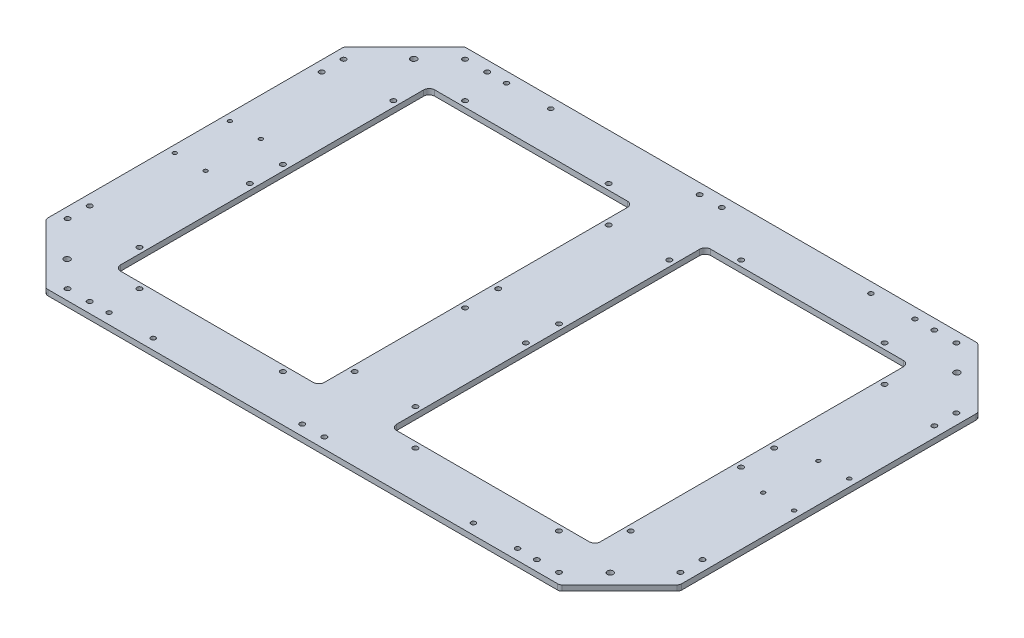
SolidWorks part; units mm, degrees
ref_plane "Ebene vorne" through (0, 0, 0) normal (0, 0, 1) x (1, 0, 0)
ref_plane "Ebene oben" through (0, 0, 0) normal (0, 1, 0) x (1, 0, 0)
ref_plane "Ebene rechts" through (0, 0, 0) normal (1, 0, 0) x (0, 0, -1)
sketch "Skizze1" plane through (0, 0, 0) normal (0, 1, 0) x (1, 0, 0)
  line L0 (-466, 381) -> (-576, 271)
  line L1 (-466, -381) -> (466, -381)
  line L2 (-466, -381) -> (-466, 381) construction
  line L3 (-466, 381) -> (466, 381)
  line L4 (466, -381) -> (466, 381) construction
  line L5 (-466, -381) -> (466, 381) construction
  line L6 (-466, 381) -> (466, -381) construction
  line L7 (-576, 271) -> (-576, -271)
  line L8 (-576, -271) -> (-466, -381)
  line L9 (466, -381) -> (576, -271)
  line L10 (576, -271) -> (576, 271)
  line L11 (576, 271) -> (466, 381)
  line L12 (-662.0681, 0) -> (0, 0) construction
  line L13 (0, 0) -> (684.1196, 0) construction
  line L14 (-53.5395, 0) -> (53.5395, 0) construction
  point P0 (0, 0)
  dimension "D1" = 932
  dimension "D2" = 762
  dimension "D3" = 45
  dimension "D4" = 110
extrude "Aufsatz-Linear austragen1" add sketch "Skizze1" along normal blind 10
hole_wizard "Durchgangsloch für M81" positions "Skizze2" profile "Skizze3" hole size "M8" standard "DIN"
sketch "Skizze2" plane through (0, 10, 0) normal (0, 1, 0) x (1, 0, 0)
  line L1 (445, -360) -> (-445, -360)
  line L2 (445, -360) -> (445, 360)
  line L3 (445, 360) -> (-445, 360)
  line L4 (-445, -360) -> (-445, 360)
  line L5 (445, -360) -> (-445, 360) construction
  line L6 (445, 360) -> (-445, -360) construction
  line L8 (0, 0) -> (0, 387.6038) construction
  line L10 (-555, 250) -> (-555, 210) construction
  line L11 (-555, 210) -> (-555, -210) construction
  line L12 (-555, -210) -> (-555, -250) construction
  line L14 (-555, 0) -> (0, 0) construction
  line L17 (555, -210) -> (555, -250) construction
  line L18 (555, 210) -> (555, -210) construction
  line L19 (555, 250) -> (555, 210) construction
  point P2 (-445, 360)
  point P5 (445, -360)
  point P6 (445, 360)
  point P7 (-445, -360)
  point P63 (-405, 360)
  point P65 (-405, -360)
  point P67 (405, -360)
  point P69 (405, 360)
  point P79 (-555, 250)
  point P81 (-555, 210)
  point P83 (-555, -210)
  point P85 (-555, -250)
  point P108 (555, 250)
  point P111 (555, 210)
  point P114 (555, -210)
  point P117 (555, -250)
  point P122 (-20, 360)
  point P124 (20, 360)
  point P126 (-20, -360)
  point P128 (20, -360)
  dimension "D1" = 720
  dimension "D2" = 890
  dimension "D3" = 40
  dimension "D4" = 40
  dimension "D5" = 1110
  dimension "D6" = 500
  dimension "D7" = 40
sketch "Skizze3" plane through (-445, 10, -360) normal (1, 0, 0) x (0, 0, 1)
  line L0 (0, 0) -> (0, 10)
  line L1 (0, 10) -> (4.5, 10)
  line L2 (4.5, 10) -> (4.5, 0)
  line L5 (4.5, 0) -> (0, 0)
  line L11 (0, -6.35) -> (0, 107.95) construction
  dimension "Bohrerdurchmesser" = 9
  dimension "Bohrungstiefe" = 10
fillet "Verrundung1" radius 10
sketch "Skizze4" plane through (0, 10, 0) normal (0, 1, 0) x (1, 0, 0)
  line L16 (-467.5147, 376.6569) -> (-571.6569, 272.5147)
  line L17 (-574, 266.8579) -> (-574, -266.8579)
  line L18 (-571.6569, -272.5147) -> (-467.5147, -376.6569)
  line L19 (-461.8579, -379) -> (461.8579, -379)
  line L20 (467.5147, -376.6569) -> (571.6569, -272.5147)
  line L21 (574, -266.8579) -> (574, 266.8579)
  line L22 (571.6569, 272.5147) -> (467.5147, 376.6569)
  line L23 (461.8579, 379) -> (-461.8579, 379)
  line L24 (-467.5147, 376.6569) -> (-571.6569, 272.5147)
  line L25 (-574, 266.8579) -> (-574, -266.8579)
  line L26 (-571.6569, -272.5147) -> (-467.5147, -376.6569)
  line L27 (-461.8579, -379) -> (461.8579, -379)
  line L28 (467.5147, -376.6569) -> (571.6569, -272.5147)
  line L29 (574, -266.8579) -> (574, 266.8579)
  line L30 (571.6569, 272.5147) -> (467.5147, 376.6569)
  line L31 (461.8579, 379) -> (-461.8579, 379)
  line L32 (-468.9289, 378.0711) -> (-573.0711, 273.9289)
  line L33 (-576, 266.8579) -> (-576, -266.8579)
  line L34 (-573.0711, -273.9289) -> (-468.9289, -378.0711)
  line L35 (-461.8579, -381) -> (461.8579, -381)
  line L36 (468.9289, -378.0711) -> (573.0711, -273.9289)
  line L37 (576, -266.8579) -> (576, 266.8579)
  line L38 (573.0711, 273.9289) -> (468.9289, 378.0711)
  line L39 (461.8579, 381) -> (-461.8579, 381)
  line L40 (-468.9289, 378.0711) -> (-573.0711, 273.9289)
  line L41 (-576, 266.8579) -> (-576, -266.8579)
  line L42 (-573.0711, -273.9289) -> (-468.9289, -378.0711)
  line L43 (-461.8579, -381) -> (461.8579, -381)
  line L44 (468.9289, -378.0711) -> (573.0711, -273.9289)
  line L45 (576, -266.8579) -> (576, 266.8579)
  line L46 (573.0711, 273.9289) -> (468.9289, 378.0711)
  line L47 (461.8579, 381) -> (-461.8579, 381)
  arc A16 (-571.6569, 272.5147) -> (-574, 266.8579) centre (-566, 266.8579) ccw
  arc A17 (-574, -266.8579) -> (-571.6569, -272.5147) centre (-566, -266.8579) ccw
  arc A18 (-467.5147, -376.6569) -> (-461.8579, -379) centre (-461.8579, -371) ccw
  arc A19 (461.8579, -379) -> (467.5147, -376.6569) centre (461.8579, -371) ccw
  arc A20 (571.6569, -272.5147) -> (574, -266.8579) centre (566, -266.8579) ccw
  arc A21 (574, 266.8579) -> (571.6569, 272.5147) centre (566, 266.8579) ccw
  arc A22 (467.5147, 376.6569) -> (461.8579, 379) centre (461.8579, 371) ccw
  arc A23 (-461.8579, 379) -> (-467.5147, 376.6569) centre (-461.8579, 371) ccw
  arc A24 (-571.6569, 272.5147) -> (-574, 266.8579) centre (-566, 266.8579) ccw
  arc A25 (-574, -266.8579) -> (-571.6569, -272.5147) centre (-566, -266.8579) ccw
  arc A26 (-467.5147, -376.6569) -> (-461.8579, -379) centre (-461.8579, -371) ccw
  arc A27 (461.8579, -379) -> (467.5147, -376.6569) centre (461.8579, -371) ccw
  arc A28 (571.6569, -272.5147) -> (574, -266.8579) centre (566, -266.8579) ccw
  arc A29 (574, 266.8579) -> (571.6569, 272.5147) centre (566, 266.8579) ccw
  arc A30 (467.5147, 376.6569) -> (461.8579, 379) centre (461.8579, 371) ccw
  arc A31 (-461.8579, 379) -> (-467.5147, 376.6569) centre (-461.8579, 371) ccw
  arc A32 (-573.0711, 273.9289) -> (-576, 266.8579) centre (-566, 266.8579) ccw
  arc A33 (-576, -266.8579) -> (-573.0711, -273.9289) centre (-566, -266.8579) ccw
  arc A34 (-468.9289, -378.0711) -> (-461.8579, -381) centre (-461.8579, -371) ccw
  arc A35 (461.8579, -381) -> (468.9289, -378.0711) centre (461.8579, -371) ccw
  arc A36 (573.0711, -273.9289) -> (576, -266.8579) centre (566, -266.8579) ccw
  arc A37 (576, 266.8579) -> (573.0711, 273.9289) centre (566, 266.8579) ccw
  arc A38 (468.9289, 378.0711) -> (461.8579, 381) centre (461.8579, 371) ccw
  arc A39 (-461.8579, 381) -> (-468.9289, 378.0711) centre (-461.8579, 371) ccw
  arc A40 (-573.0711, 273.9289) -> (-576, 266.8579) centre (-566, 266.8579) ccw
  arc A41 (-576, -266.8579) -> (-573.0711, -273.9289) centre (-566, -266.8579) ccw
  arc A42 (-468.9289, -378.0711) -> (-461.8579, -381) centre (-461.8579, -371) ccw
  arc A43 (461.8579, -381) -> (468.9289, -378.0711) centre (461.8579, -371) ccw
  arc A44 (573.0711, -273.9289) -> (576, -266.8579) centre (566, -266.8579) ccw
  arc A45 (576, 266.8579) -> (573.0711, 273.9289) centre (566, 266.8579) ccw
  arc A46 (468.9289, 378.0711) -> (461.8579, 381) centre (461.8579, 371) ccw
  arc A47 (-461.8579, 381) -> (-468.9289, 378.0711) centre (-461.8579, 371) ccw
  dimension "D1" = 2
  dimension "D2" = 0
extrude "Schnitt-Linear austragen1" cut sketch "Skizze4" against normal through all
hole_wizard "Durchgangsloch für M101" positions "Skizze5" profile "Skizze6" hole size "M10" standard "DIN"
sketch "Skizze5" plane through (0, 10, 0) normal (0, 1, 0) x (1, 0, 0)
  line L1 (492, -314) -> (-492, -314)
  line L2 (492, -314) -> (492, 314)
  line L3 (492, 314) -> (-492, 314)
  line L4 (-492, -314) -> (-492, 314)
  line L5 (492, -314) -> (-492, 314) construction
  line L6 (492, 314) -> (-492, -314) construction
  line L7 (574, -266.8579) -> (574, 266.8579) construction
  line L8 (461.8579, 379) -> (-461.8579, 379) construction
  point P2 (-492, 314)
  point P5 (492, -314)
  point P6 (492, 314)
  point P7 (-492, -314)
  dimension "D1" = 65
  dimension "D2" = 82
sketch "Skizze6" plane through (-492, 10, -314) normal (1, 0, 0) x (0, 0, 1)
  line L0 (0, 0) -> (0, 10)
  line L1 (0, 10) -> (5.5, 10)
  line L2 (5.5, 10) -> (5.5, 0)
  line L5 (5.5, 0) -> (0, 0)
  line L11 (0, -6.35) -> (0, 107.95) construction
  dimension "Bohrerdurchmesser" = 11
  dimension "Bohrungstiefe" = 10
hole_wizard "Ø7.0 (7) Durchmesser Bohrung1" positions "Skizze7" profile "Skizze8" hole size "Ø7.0" standard "DIN"
sketch "Skizze7" plane through (0, 0, 0) normal (0, -1, 0) x (-1, 0, 0)
  line L0 (0, 0) -> (-616.7113, 0) construction
  line L1 (-53.5395, 0) -> (53.5395, 0) construction
  line L3 (0, 53.599) -> (0, -53.599) construction
  line L4 (0, 0) -> (0, 419.4426) construction
  point P0 (-561, 50)
  point P3 (-505, 50)
  point P6 (-561, -50)
  point P9 (-505, -50)
  point P34 (505, -50)
  point P35 (561, -50)
  point P36 (505, 50)
  point P37 (561, 50)
  dimension "D1" = 100
  dimension "D2" = 56
  dimension "D3" = 505
sketch "Skizze8" plane through (561, 0, -50) normal (1, 0, 0) x (0, 0, -1)
  line L0 (0, 0) -> (0, 14.103)
  line L1 (0, 14.103) -> (3.5, 12)
  line L2 (3.5, 12) -> (3.5, 0)
  line L5 (3.5, 0) -> (0, 0)
  line L10 (0, 14.103) -> (-3.5, 12) construction
  line L11 (0, -6.35) -> (0, 107.95) construction
  dimension "Bohrerdurchmesser" = 7
  dimension "Bohrungstiefe" = 12
  dimension "Spitzenwinkel" = 118
sketch "Skizze10" plane through (0, 0, 0) normal (0, -1, 0) x (1, 0, 0)
  line L0 (0, 0) -> (0, 411.895) construction
  line L1 (-424.5, -284.5) -> (-75.5, -284.5)
  line L2 (-434.5, -274.5) -> (-434.5, 274.5)
  line L3 (-424.5, 284.5) -> (-75.5, 284.5)
  line L4 (-65.5, -274.5) -> (-65.5, 274.5)
  line L5 (-434.5, -284.5) -> (-65.5, 284.5) construction
  line L6 (-434.5, 284.5) -> (-65.5, -284.5) construction
  line L7 (434.5, 284.5) -> (65.5, -284.5) construction
  line L8 (434.5, -284.5) -> (65.5, 284.5) construction
  line L9 (65.5, -274.5) -> (65.5, 274.5)
  line L10 (424.5, 284.5) -> (75.5, 284.5)
  line L11 (434.5, -274.5) -> (434.5, 274.5)
  line L12 (424.5, -284.5) -> (75.5, -284.5)
  arc A0 (-434.5, -274.5) -> (-424.5, -284.5) centre (-424.5, -274.5) ccw
  arc A1 (-75.5, -284.5) -> (-65.5, -274.5) centre (-75.5, -274.5) ccw
  arc A2 (-65.5, 274.5) -> (-75.5, 284.5) centre (-75.5, 274.5) ccw
  arc A3 (-424.5, 284.5) -> (-434.5, 274.5) centre (-424.5, 274.5) ccw
  arc A4 (424.5, 284.5) -> (434.5, 274.5) centre (424.5, 274.5) cw
  arc A5 (65.5, 274.5) -> (75.5, 284.5) centre (75.5, 274.5) cw
  arc A6 (75.5, -284.5) -> (65.5, -274.5) centre (75.5, -274.5) cw
  arc A7 (434.5, -274.5) -> (424.5, -284.5) centre (424.5, -274.5) cw
  point P0 (-250, 0)
  point P36 (250, 0)
  dimension "D4" = 10
  dimension "D1" = 369
  dimension "D2" = 569
  dimension "D3" = 250
extrude "Schnitt-Linear austragen3" cut sketch "Skizze10" against normal through all
sketch "Skizze11" [suppressed] plane through (0, 0, 0) normal (0, -1, 0) x (1, 0, 0)
  line L1 (-437.5, -147.5) -> (-262.5, -147.5)
  line L2 (-447.5, -137.5) -> (-447.5, 137.5)
  line L3 (-437.5, 147.5) -> (-262.5, 147.5)
  line L4 (-252.5, -137.5) -> (-252.5, 137.5)
  line L5 (-447.5, -147.5) -> (-252.5, 147.5) construction
  line L6 (-447.5, 147.5) -> (-252.5, -147.5) construction
  line L7 (447.5, 147.5) -> (252.5, -147.5) construction
  line L8 (447.5, -147.5) -> (252.5, 147.5) construction
  line L9 (252.5, -137.5) -> (252.5, 137.5)
  line L10 (437.5, 147.5) -> (262.5, 147.5)
  line L11 (447.5, -137.5) -> (447.5, 137.5)
  line L12 (437.5, -147.5) -> (262.5, -147.5)
  line L13 (0, 0) -> (0, 303.9427) construction
  line L14 (0, -53.599) -> (0, 53.599) construction
  arc A0 (-447.5, -137.5) -> (-437.5, -147.5) centre (-437.5, -137.5) ccw
  arc A1 (-262.5, -147.5) -> (-252.5, -137.5) centre (-262.5, -137.5) ccw
  arc A2 (-252.5, 137.5) -> (-262.5, 147.5) centre (-262.5, 137.5) ccw
  arc A3 (-437.5, 147.5) -> (-447.5, 137.5) centre (-437.5, 137.5) ccw
  arc A4 (437.5, 147.5) -> (447.5, 137.5) centre (437.5, 137.5) cw
  arc A5 (252.5, 137.5) -> (262.5, 147.5) centre (262.5, 137.5) cw
  arc A6 (262.5, -147.5) -> (252.5, -137.5) centre (262.5, -137.5) cw
  arc A7 (447.5, -137.5) -> (437.5, -147.5) centre (437.5, -137.5) cw
  point P0 (-350, 0)
  point P38 (350, 0)
  dimension "D4" = 10
  dimension "D1" = 295
  dimension "D2" = 195
  dimension "D3" = 350
extrude "Schnitt-Linear austragen4" [suppressed] cut sketch "Skizze11" against normal through all
sketch "Skizze12" plane through (0, 0, 0) normal (0, -1, 0) x (1, 0, 0)
  line L0 (120, 295) -> (380, 295) construction
  line L1 (55, 230) -> (55, -230) construction
  line L2 (120, -295) -> (380, -295) construction
  line L3 (445, 230) -> (445, -230) construction
  line L4 (-75.5, 284.5) -> (-424.5, 284.5) construction
  line L7 (53.5395, 0) -> (-53.5395, 0) construction
  line L8 (445, 30) -> (55, 30) construction
  line L9 (445, -30) -> (55, -30) construction
  line L10 (120, 295) -> (120, -295) construction
  line L11 (380, 295) -> (380, -295) construction
  line L12 (-424.5, -284.5) -> (-75.5, -284.5) construction
  line L13 (434.5, -274.5) -> (434.5, 274.5) construction
  line L14 (65.5, 274.5) -> (65.5, -274.5) construction
  point P16 (445, -30)
  point P17 (445, 30)
  point P18 (55, 30)
  point P19 (55, -30)
  dimension "D1" = 10.5
  dimension "D2" = 54.5
  dimension "D3" = 10.5
  dimension "D4" = 230
  dimension "D5" = 230
  dimension "D6" = 230
  dimension "D7" = 230
  dimension "D8" = 30
  dimension "D9" = 30
  dimension "D10" = 10.5
  dimension "D11" = 54.5
  dimension "D12" = 10.5
hole_wizard "Durchgangsloch für M83" positions "3D-Skizze2" profile "Skizze14" hole size "M8" standard "DIN"
sketch3d "3D-Skizze2"
  point P0 (55, 0, 230)
  point P3 (120, 0, 295)
  point P6 (380, 0, 295)
  point P9 (445, 0, 230)
  point P12 (445, 0, 30)
  point P15 (445, 0, -30)
  point P18 (445, 0, -230)
  point P21 (380, 0, -295)
  point P24 (120, 0, -295)
  point P27 (55, 0, -230)
  point P30 (55, 0, -30)
  point P33 (55, 0, 30)
sketch "Skizze14" plane through (55, 0, 230) normal (1, 0, 0) x (0, 0, -1)
  line L0 (0, 0) -> (0, 12.7039)
  line L1 (0, 12.7039) -> (4.5, 10)
  line L2 (4.5, 10) -> (4.5, 0)
  line L5 (4.5, 0) -> (0, 0)
  line L10 (0, 12.7039) -> (-4.5, 10) construction
  line L11 (0, -6.35) -> (0, 107.95) construction
  dimension "Bohrerdurchmesser" = 9
  dimension "Bohrungstiefe" = 10
  dimension "Spitzenwinkel" = 118
sketch "Skizze15" plane through (0, 0, 0) normal (0, -1, 0) x (1, 0, 0)
  line L0 (-370, 360) -> (-290, 360) construction
  line L1 (290, 360) -> (370, 360) construction
  line L2 (-461.8579, 379) -> (461.8579, 379) construction
  line L3 (0, -53.599) -> (0, 53.599) construction
  dimension "D1" = 80
  dimension "D2" = 19
  dimension "D3" = 80
  dimension "D4" = 290
  dimension "D5" = 290
hole_wizard "Durchgangsloch für M82" positions "3D-Skizze3" profile "Skizze16" hole size "M8" standard "DIN"
sketch3d "3D-Skizze3"
  point P0 (-370, 0, 360)
  point P3 (-290, 0, 360)
  point P6 (370, 0, 360)
  point P9 (290, 0, 360)
sketch "Skizze16" plane through (-370, 0, 360) normal (1, 0, 0) x (0, 0, -1)
  line L0 (0, 0) -> (0, 12.5236)
  line L1 (0, 12.5236) -> (4.2, 10)
  line L2 (4.2, 10) -> (4.2, 0)
  line L5 (4.2, 0) -> (0, 0)
  line L10 (0, 12.5236) -> (-4.2, 10) construction
  line L11 (0, -6.35) -> (0, 107.95) construction
  dimension "Bohrerdurchmesser" = 8.4
  dimension "Bohrungstiefe" = 10
  dimension "Spitzenwinkel" = 118
mirror "Spiegeln1" about plane through (0, 0, 0) normal (1, 0, 0) of "Durchgangsloch für M83"
mirror "Spiegeln2" about plane through (0, 0, 0) normal (0, 0, 1) of "Durchgangsloch für M82"
